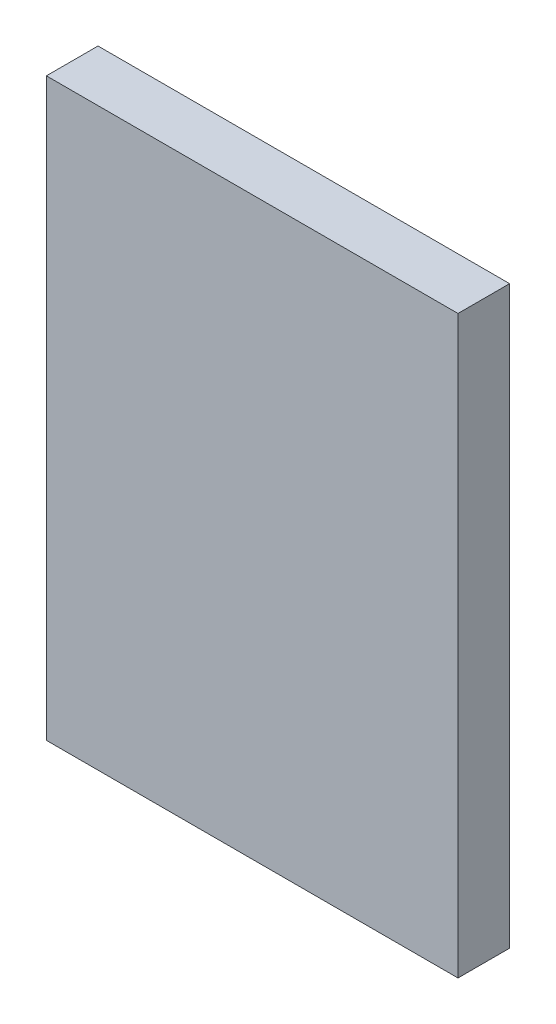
SolidWorks part; units mm, degrees
ref_plane "Front Plane" through (0, 0, 0) normal (0, 0, 1) x (1, 0, 0)
ref_plane "Top Plane" through (0, 0, 0) normal (0, 1, 0) x (1, 0, 0)
ref_plane "Right Plane" through (0, 0, 0) normal (1, 0, 0) x (0, 0, -1)
sketch "Sketch1" plane through (0, 0, 0) normal (0, 0, 1) x (1, 0, 0)
  line L1 (0, 0) -> (69.85, 0)
  line L2 (0, 0) -> (0, 97.663)
  line L3 (0, 97.663) -> (69.85, 97.663)
  line L4 (69.85, 0) -> (69.85, 97.663)
  dimension "D1" = 97.663
  dimension "D2" = 69.85
extrude "Boss-Extrude1" add sketch "Sketch1" along normal blind 8.763
